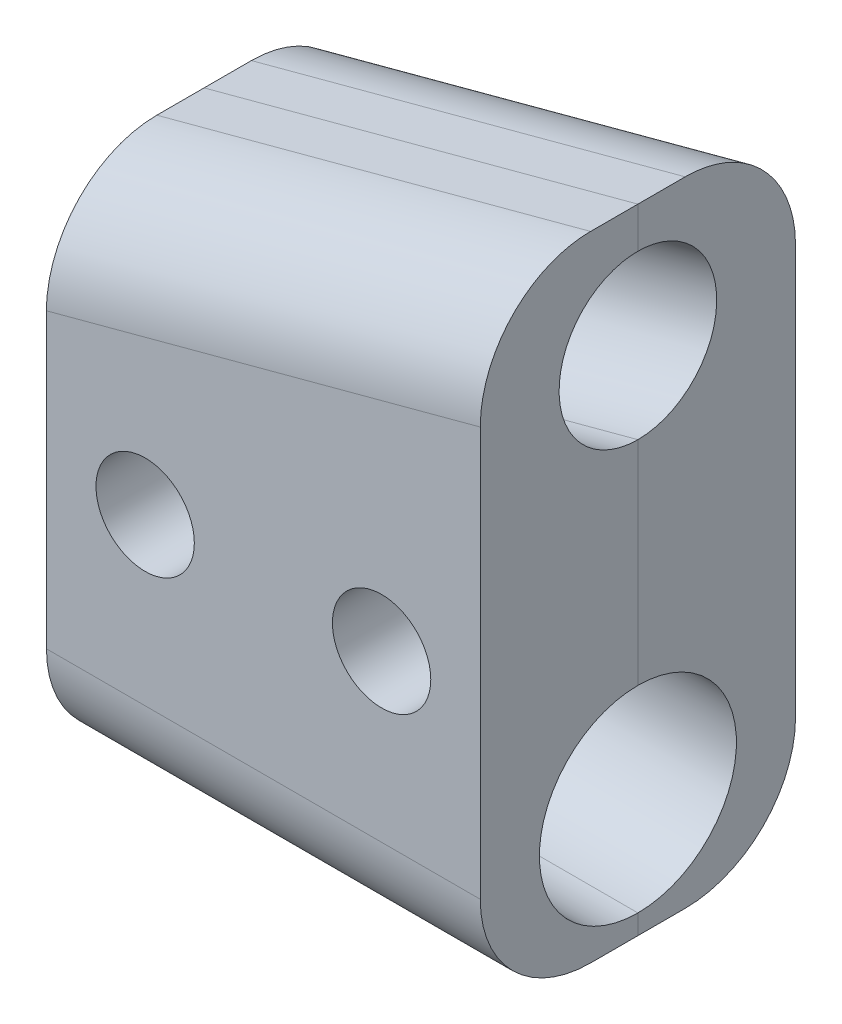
SolidWorks part; units mm, degrees
ref_plane "Front Plane" through (0, 0, 0) normal (0, 0, 1) x (1, 0, 0)
ref_plane "Top Plane" through (0, 0, 0) normal (0, 1, 0) x (1, 0, 0)
ref_plane "Right Plane" through (0, 0, 0) normal (1, 0, 0) x (0, 0, -1)
sketch "Sketch1" plane through (0, 0, 0) normal (0, 0, 1) x (1, 0, 0)
  line L0 (0, 0) -> (0, 24.1358) construction
  line L1 (0, 0) -> (0, -22.225) construction
  line L2 (0, 14.2748) -> (17.4752, 18.9573) construction
  line L3 (0, -12.7) -> (17.4752, -12.7) construction
  line L4 (0, 0) -> (17.4752, 0) construction
  line L5 (0, 14.2748) -> (-17.4752, 9.5923) construction
  line L6 (-17.4752, -22.225) -> (17.4752, -22.225)
  line L7 (17.4752, -22.225) -> (17.4752, 28.8183)
  line L8 (17.4752, 28.8183) -> (-17.4752, 19.4533)
  line L9 (-17.4752, 19.4533) -> (-17.4752, -22.225)
  line L10 (0, -12.7) -> (-17.4752, -12.7) construction
  circle A0 centre (-9.525, 0) radius 5.9944
  circle A1 centre (-9.525, 0) radius 3.9624
  circle A2 centre (9.525, 0) radius 3.9624
  circle A4 centre (9.525, 0) radius 5.9944
  dimension "D10" = 7.9248
  dimension "D11" = 11.9888
  dimension "D12" = 19.05
  dimension "D2" = 15
  dimension "D3" = 12.7
  dimension "D4" = 14.2748
  dimension "D5" = 17.4752
  dimension "D6" = 17.4752
  dimension "D7" = 9.525
  dimension "D8" = 9.525
  dimension "D9" = 9.525
sketch "Sketch2" plane through (0, 0, 0) normal (0, 0, 1) x (1, 0, 0)
  line L0 (-17.4752, -22.225) -> (17.4752, -22.225) construction
  line L1 (17.4752, -22.225) -> (17.4752, 28.8183) construction
  line L2 (17.4752, 28.8183) -> (-17.4752, 19.4533) construction
  line L3 (-17.4752, 19.4533) -> (-17.4752, -22.225) construction
  line L4 (-17.4752, -22.225) -> (17.4752, -22.225)
  line L5 (17.4752, -22.225) -> (17.4752, 28.8183)
  line L6 (17.4752, 28.8183) -> (-17.4752, 19.4533)
  line L7 (-17.4752, 19.4533) -> (-17.4752, -22.225)
  circle A1 centre (-9.525, 0) radius 3.9624 construction
  circle A2 centre (9.525, 0) radius 3.9624 construction
  circle A4 centre (-9.525, 0) radius 3.9624
  circle A5 centre (9.525, 0) radius 3.9624
extrude "Boss-Extrude1" add sketch "Sketch2" against normal blind 12.7
sketch "Sketch3" plane through (0, 0, 0) normal (0, 0, 1) x (1, 0, 0)
  line L0 (-17.4752, -22.225) -> (17.4752, -22.225) construction
  line L1 (17.4752, -22.225) -> (17.4752, 28.8183) construction
  line L2 (17.4752, 28.8183) -> (-17.4752, 19.4533) construction
  line L3 (-17.4752, 19.4533) -> (-17.4752, -22.225) construction
  line L4 (-17.4752, -22.225) -> (17.4752, -22.225)
  line L5 (17.4752, -22.225) -> (17.4752, 28.8183)
  line L6 (17.4752, 28.8183) -> (-17.4752, 19.4533)
  line L7 (-17.4752, 19.4533) -> (-17.4752, -22.225)
  circle A0 centre (-9.525, 0) radius 3.9624 construction
  circle A2 centre (9.525, 0) radius 3.9624 construction
  circle A3 centre (-9.525, 0) radius 3.9624
  circle A5 centre (9.525, 0) radius 3.9624
extrude "Boss-Extrude2" add sketch "Sketch3" along normal blind 12.7 separate body
sketch "Sketch4" plane through (0, 0, 0) normal (1, 0, 0) x (0, 0, -1)
  circle A0 centre (0, -12.7) radius 7.9375
  dimension "D1" = 15.875
extrude "Cut-Extrude1" cut sketch "Sketch4" against normal mid plane 50.8
ref_plane "Plane1" through (0, 14.2748, 0) normal (0.9659, 0.2588, 0) x (0, 0, -1)
sketch "Sketch5" plane through (0, 14.2748, 0) normal (0.9659, 0.2588, 0) x (0, 0, -1)
  circle A0 centre (0, 0) radius 6.35
  dimension "D1" = 12.7
extrude "Cut-Extrude2" cut sketch "Sketch5" against normal mid plane 50.8
fillet "Fillet1" radius 8.89 2 edges at (0, 24.1358, 12.7) (0, -22.225, 12.7)
fillet "Fillet2" radius 8.89 2 edges at (0, 24.1358, -12.7) (0, -22.225, -12.7)
